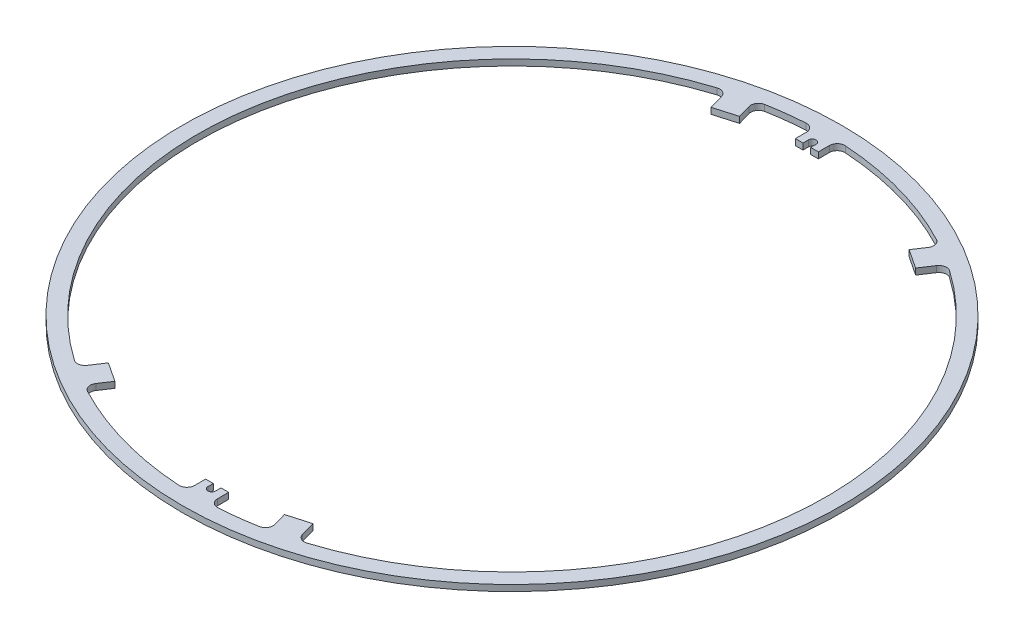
SolidWorks part; units mm, degrees
ref_plane "前视基准面" through (0, 0, 0) normal (0, 0, 1) x (1, 0, 0)
ref_plane "上视基准面" through (0, 0, 0) normal (0, 1, 0) x (1, 0, 0)
ref_plane "右视基准面" through (0, 0, 0) normal (1, 0, 0) x (0, 0, -1)
sketch "草图1" plane through (0, 0, 0) normal (0, 1, 0) x (1, 0, 0)
  circle A0 centre (0, 0) radius 43
  circle A1 centre (0, 0) radius 41
  circle A2 centre (0, 0) radius 35 construction
  dimension "D1" = 86
  dimension "D2" = 2
  dimension "D3" = 70
extrude "凸台-拉伸1" add sketch "草图1" along normal blind 0.8
sketch "草图2" plane through (0, 0.8, 0) normal (0, 1, 0) x (1, 0, 0)
  line L0 (0, 0) -> (0, 47.3857) construction
  line L1 (-1.5, 40.9726) -> (-1.5, 38.4726)
  line L2 (-1.5, 38.4726) -> (1.5, 38.4726)
  line L3 (1.5, 40.9726) -> (1.5, 38.4726)
  line L4 (0, 0) -> (51.4644, 0) construction
  line L5 (1.5, -40.9726) -> (1.5, -38.4726)
  line L6 (-1.5, -40.9726) -> (-1.5, -38.4726)
  line L7 (-1.5, -38.4726) -> (1.5, -38.4726)
  circle A0 centre (0, 0) radius 41 construction
  circle A1 centre (0, 0) radius 41
  point P10 (0, 38.4726)
  dimension "D1" = 2.5
  dimension "D2" = 3
extrude "凸台-拉伸2" add sketch "草图2" against normal up to surface (0.8 mm away) contours L7 L6 L5 M8 | L3 L1 L2 M8
fillet "圆角1" radius 1 2 edges at (1.5, 0.4, -40.9726) (-1.5, 0.4, -40.9726)
fillet "圆角2" radius 1 2 edges at (1.5, 0.4, 40.9726) (-1.5, 0.4, 40.9726)
sketch "草图3" plane through (0, 0, 0) normal (0, -1, 0) x (1, 0, 0)
  line L0 (0, 39.1726) -> (0, 38.4726) construction
  line L1 (1.5, 38.4726) -> (-1.5, 38.4726) construction
  line L2 (-0.5, 39.1726) -> (-0.5, 36.1726)
  line L3 (-0.5, 36.1726) -> (0.5, 36.1726)
  line L4 (0.5, 36.1726) -> (0.5, 39.1726)
  line L5 (0, 0) -> (11.294, 0) construction
  line L6 (0, -39.1726) -> (0, -38.4726) construction
  line L7 (0.5, -36.1726) -> (0.5, -39.1726)
  line L8 (-0.5, -36.1726) -> (0.5, -36.1726)
  line L9 (-0.5, -39.1726) -> (-0.5, -36.1726)
  arc A0 (0.5, 39.1726) -> (-0.5, 39.1726) centre (0, 39.1726) ccw
  arc A1 (0.5, -39.1726) -> (-0.5, -39.1726) centre (0, -39.1726) cw
  dimension "D1" = 1
  dimension "D2" = 3
  dimension "D3" = 0.7
extrude "切除-拉伸1" cut sketch "草图3" against normal through all
sketch "草图4" plane through (0, 0.8, 0) normal (0, 1, 0) x (1, 0, 0)
  line L0 (0, 0) -> (-22.6294, -34.1893) construction
  line L1 (0, 0) -> (0, -48.4381) construction
  line L2 (-22.6294, -34.1893) -> (-20.9736, -31.6877)
  line L3 (-20.9736, -31.6877) -> (-18.4719, -33.3435)
  line L4 (-18.4719, -33.3435) -> (-20.0671, -35.7535)
  line L5 (22.6294, 34.1893) -> (20.9736, 31.6877)
  line L6 (20.9736, 31.6877) -> (18.4719, 33.3435)
  line L7 (18.4719, 33.3435) -> (20.0671, 35.7535)
  arc A0 (-2.5625, 40.9198) -> (-2.5625, -40.9198) centre (0, 0) ccw construction
  arc A1 (-22.6294, -34.1893) -> (-20.0671, -35.7535) centre (0, 0) ccw
  arc A2 (22.6294, 34.1893) -> (20.0671, 35.7535) centre (0, 0) ccw
  point P16 (0, 0)
  dimension "D1" = 3
  dimension "D2" = 3
  dimension "D4" = 33.5
  dimension "D3" = 2
extrude "凸台-拉伸3" add sketch "草图4" against normal up to surface (0.8 mm away)
fillet "圆角3" radius 1 4 edges at (22.6294, 0.4, -34.1893) (20.0671, 0.4, -35.7535) (-20.0671, 0.4, 35.7535) (-22.6294, 0.4, 34.1893)
sketch "草图5" plane through (0, 0, 0) normal (0, -1, 0) x (1, 0, 0)
  line L0 (0, 0) -> (-20.9736, 31.6877) construction
  line L1 (0, 0) -> (11.3603, 39.3947) construction
  line L2 (11.3603, 39.3947) -> (10.5291, 36.5122)
  line L3 (10.5291, 36.5122) -> (7.6466, 37.3434)
  line L4 (7.6466, 37.3434) -> (8.4473, 40.1203)
  line L5 (-7.6466, -37.3434) -> (-8.4473, -40.1203)
  line L6 (-10.5291, -36.5122) -> (-7.6466, -37.3434)
  line L7 (-11.3603, -39.3947) -> (-10.5291, -36.5122)
  arc A0 (23.4771, -33.6129) -> (2.5625, 40.9198) centre (0, 0) ccw construction
  arc A1 (11.3603, 39.3947) -> (8.4473, 40.1203) centre (0, 0) ccw
  arc A2 (-11.3603, -39.3947) -> (-8.4473, -40.1203) centre (0, 0) ccw
  point P17 (0, 0)
  dimension "D3" = 2
  dimension "D1" = 3
  dimension "D2" = 3
extrude "凸台-拉伸4" add sketch "草图5" against normal up to surface (0.8 mm away)
fillet "圆角4" radius 1 4 edges at (-8.4473, 0.4, -40.1203) (-11.3603, 0.4, -39.3947) (8.4473, 0.4, 40.1203) (11.3603, 0.4, 39.3947)
